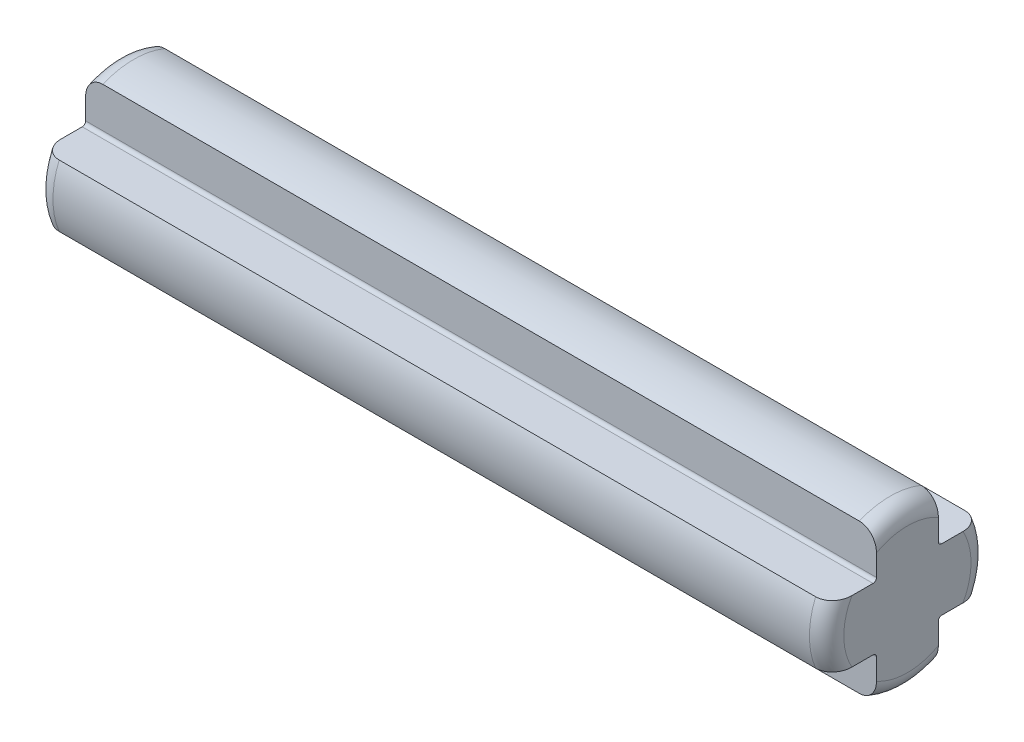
SolidWorks part; units mm, degrees
ref_plane "Alzado" through (0, 0, 0) normal (0, 0, 1) x (1, 0, 0)
ref_plane "Planta" through (0, 0, 0) normal (0, 1, 0) x (1, 0, 0)
ref_plane "Vista lateral" through (0, 0, 0) normal (1, 0, 0) x (0, 0, -1)
sketch "Croquis1" plane through (0, 0, 0) normal (1, 0, 0) x (0, 0, -1)
  line L0 (-3.7919, 0) -> (3.9132, 0) construction
  line L1 (-0.9, 2.1708) -> (-0.9, 1)
  line L2 (-2.1708, 0.9) -> (-1, 0.9)
  line L3 (2.1708, 0.9) -> (1, 0.9)
  line L4 (0.9, 2.1708) -> (0.9, 1)
  line L5 (0, 3.4809) -> (0, -0.8787) construction
  line L6 (0.9, -2.1708) -> (0.9, -1)
  line L7 (2.1708, -0.9) -> (1, -0.9)
  line L8 (-2.1708, -0.9) -> (-1, -0.9)
  line L9 (-0.9, -2.1708) -> (-0.9, -1)
  arc A0 (-2.1708, 0.9) -> (-2.1708, -0.9) centre (0, 0) ccw
  arc A1 (0.9, 2.1708) -> (-0.9, 2.1708) centre (0, 0) ccw
  arc A2 (-1, 0.9) -> (-0.9, 1) centre (-1, 1) ccw
  arc A3 (1, 0.9) -> (0.9, 1) centre (1, 1) cw
  arc A4 (2.1708, 0.9) -> (2.1708, -0.9) centre (0, 0) cw
  arc A5 (1, -0.9) -> (0.9, -1) centre (1, -1) ccw
  arc A6 (-1, -0.9) -> (-0.9, -1) centre (-1, -1) cw
  arc A7 (0.9, -2.1708) -> (-0.9, -2.1708) centre (0, 0) cw
  dimension "D1" = 2.35
  dimension "D4" = 0.1
  dimension "D2" = 1.8
  dimension "D3" = 1.8
extrude "Extruir1" add sketch "Croquis1" along normal mid plane 23
fillet "Redondeo1" radius 0.5 8 edges at (11.5, 2.35, 0) (11.5, 0, -2.35) (11.5, -2.35, 0) (11.5, 0, 2.35) (-11.5, -2.35, 0) (-11.5, 0, -2.35) (-11.5, 2.35, 0) (-11.5, 0, 2.35)
